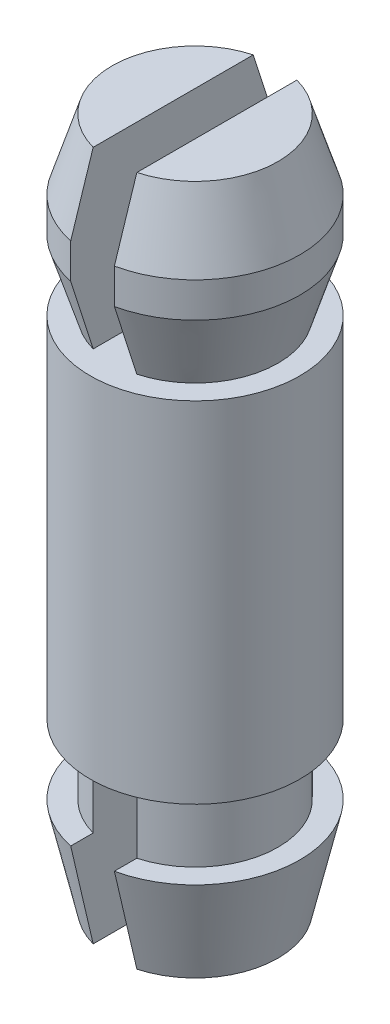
SolidWorks part; units mm, degrees
ref_plane "Front" through (0, 0, 0) normal (0, 0, 1) x (1, 0, 0)
ref_plane "Top" through (0, 0, 0) normal (0, 1, 0) x (1, 0, 0)
ref_plane "Right" through (0, 0, 0) normal (1, 0, 0) x (0, 0, -1)
sketch "Эскиз1" plane through (0, 0, 0) normal (0, 0, 1) x (1, 0, 0)
  line L0 (0, -3.8) -> (0, 12) construction
  line L1 (0, -3.8) -> (1.9, -3.8)
  line L2 (1.9, 8) -> (2.4, 9.6)
  line L3 (2.4, 9.6) -> (2.4, 10.4)
  line L4 (2.4, 10.4) -> (1.9, 12)
  line L5 (1.9, 0) -> (2.4, 0)
  line L6 (2.4, 0) -> (2.4, 8)
  line L7 (2.4, 8) -> (1.9, 8)
  line L8 (1.9, 12) -> (0, 12)
  line L9 (1.9, -3.8) -> (2.4, -1.6)
  line L10 (2.4, -1.6) -> (1.9, -1.6)
  line L11 (1.9, -1.6) -> (1.9, 0)
  line L12 (0, -3.8) -> (0, 12)
  dimension "D1" = 1.6
  dimension "D2" = 3.8
  dimension "D3" = 4.8
  dimension "D4" = 3.8
  dimension "D5" = 1.6
  dimension "D6" = 4
  dimension "D7" = 8
  dimension "D8" = 3.8
revolve "Повернуть1" add sketch "Эскиз1" angle 360 about L0
sketch "Эскиз2" plane through (0, 0, 0) normal (0, 0, 1) x (1, 0, 0)
  line L0 (1.9, 12) -> (-1.9, 12) construction
  line L1 (-0.5, 12) -> (0.5, 12)
  line L2 (-0.5, 12) -> (-0.5, 8)
  line L3 (-0.5, 8) -> (0.5, 8)
  line L4 (0.5, 12) -> (0.5, 8)
  line L5 (2.4, 8) -> (-2.4, 8) construction
  line L6 (-1.9, -3.8) -> (1.9, -3.8) construction
  line L7 (-0.5, 0) -> (0.5, 0)
  line L8 (-0.5, 0) -> (-0.5, -3.8)
  line L9 (-0.5, -3.8) -> (0.5, -3.8)
  line L10 (0.5, 0) -> (0.5, -3.8)
  dimension "D1" = 1
extrude "Вытянуть1" cut sketch "Эскиз2" against normal through all and the other way through all
